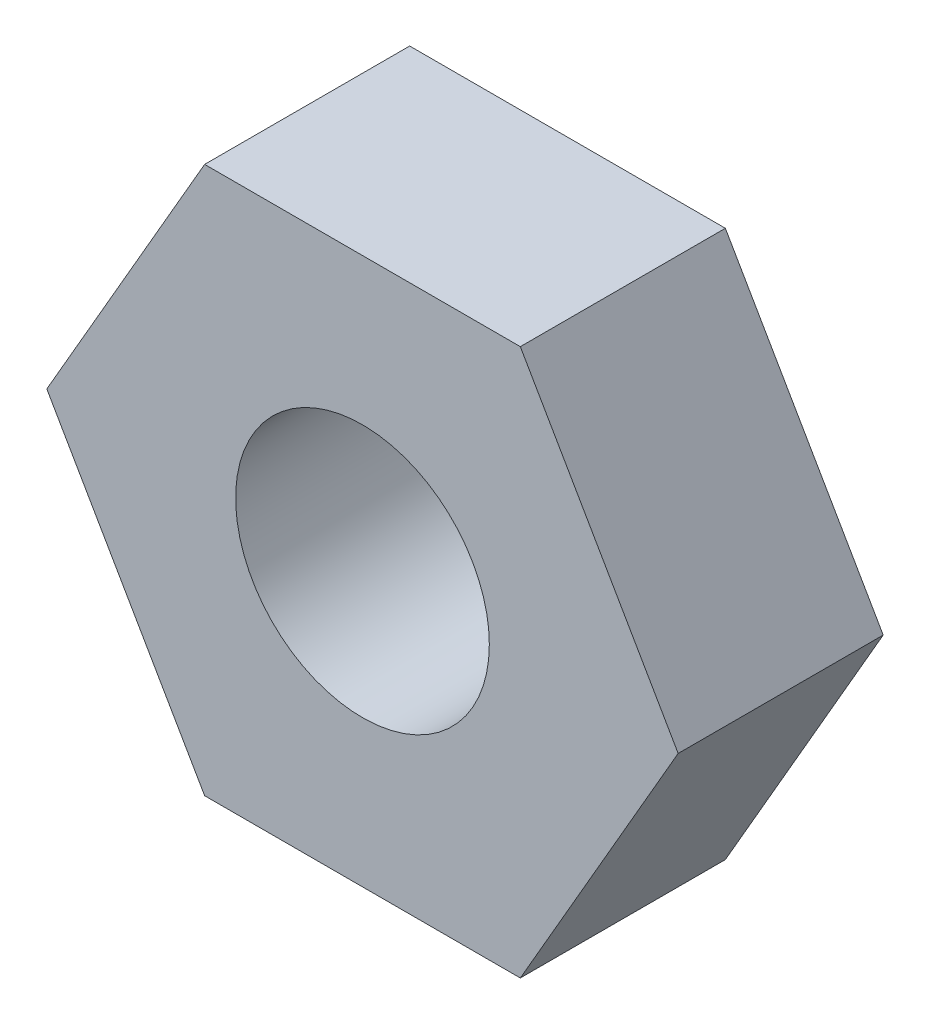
SolidWorks part; units mm, degrees
ref_plane "Front Plane" through (0, 0, 0) normal (0, 0, 1) x (1, 0, 0)
ref_plane "Top Plane" through (0, 0, 0) normal (0, 1, 0) x (1, 0, 0)
ref_plane "Right Plane" through (0, 0, 0) normal (1, 0, 0) x (0, 0, -1)
sketch "Sketch1" plane through (0, 0, 0) normal (0, 0, 1) x (1, 0, 0)
  line L1 (1.8331, 3.175) -> (-1.8331, 3.175)
  line L2 (-1.8331, 3.175) -> (-3.6662, 0)
  line L3 (-3.6662, 0) -> (-1.8331, -3.175)
  line L4 (-1.8331, -3.175) -> (1.8331, -3.175)
  line L5 (1.8331, -3.175) -> (3.6662, 0)
  line L6 (3.6662, 0) -> (1.8331, 3.175)
  circle A0 centre (0, 0) radius 3.175 construction
  dimension "D1" = 6.35
extrude "Boss-Extrude1" add sketch "Sketch1" along normal blind 2.3813
hole_wizard "#4 Clearance Hole1" positions "Sketch3" profile "Sketch2" hole size "#4" standard "ANSI Inch"
sketch "Sketch3" plane through (0, 0, 2.3813) normal (0, 0, 1) x (1, 0, 0)
  point P0 (0, 0)
sketch "Sketch2" plane through (0, 0, 2.3813) normal (1, 0, 0) x (0, -1, 0)
  line L0 (0, 0) -> (0, 2.3812)
  line L1 (0, 2.3812) -> (1.4732, 2.3812)
  line L2 (1.4732, 2.3812) -> (1.4732, 0)
  line L5 (1.4732, 0) -> (0, 0)
  line L11 (0, -6.35) -> (0, 107.95) construction
  dimension "Thru Hole Dia." = 2.9464
  dimension "Thru Hole Depth" = 2.3813
